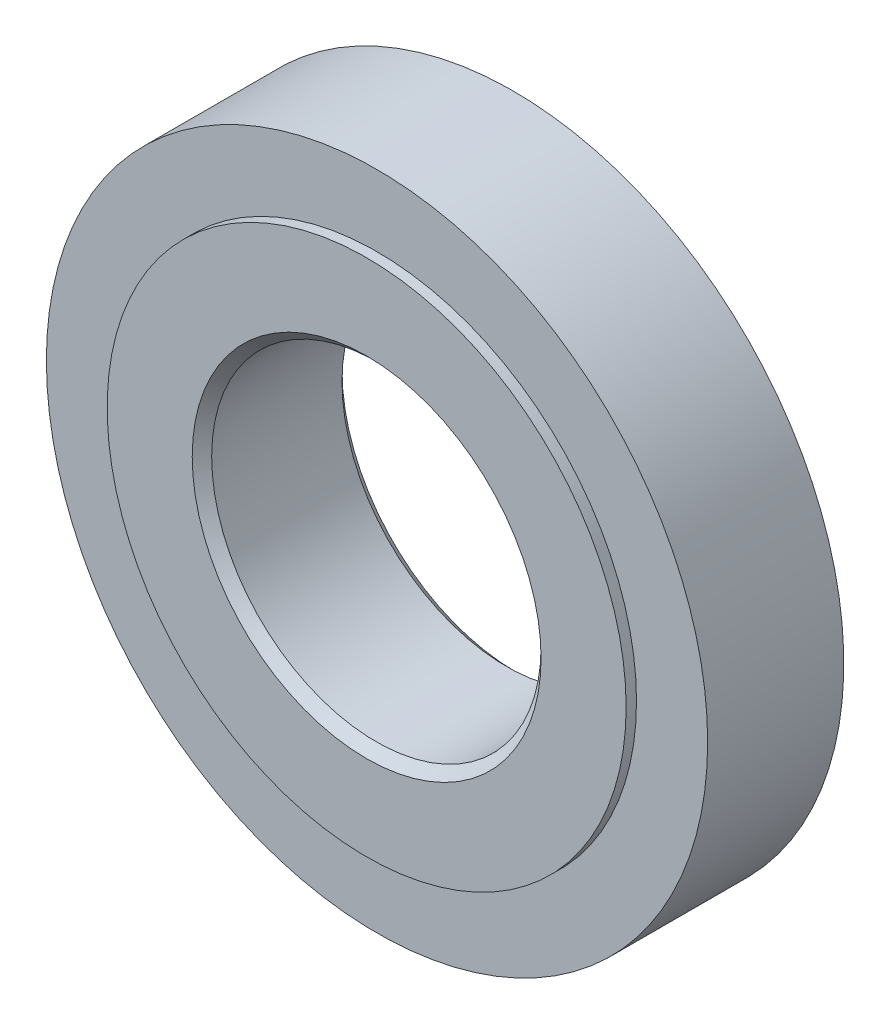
SolidWorks part; units mm, degrees
ref_plane "Front" through (0, 0, 0) normal (0, 0, 1) x (1, 0, 0)
ref_plane "Top" through (0, 0, 0) normal (0, 1, 0) x (1, 0, 0)
ref_plane "Right" through (0, 0, 0) normal (1, 0, 0) x (0, 0, -1)
sketch "Sketch1" plane through (0, 0, 0) normal (0, 0, 1) x (1, 0, 0)
  circle A0 centre (0, 0) radius 51
  dimension "OD" = 102
extrude "Extrude1" add sketch "Sketch1" along normal mid plane 23.1
sketch "Sketch2" plane through (0, 0, 11.55) normal (0, 0, 1) x (1, 0, 0)
  circle A0 centre (0, 0) radius 40.025
  dimension "MG" = 80.05
extrude "Cut-Extrude1" cut sketch "Sketch2" against normal blind 1.6 contours A0 M2
sketch "Sketch3" plane through (0, 0, -11.55) normal (0, 0, -1) x (-1, 0, 0)
  circle A0 centre (0, 0) radius 40.025
  dimension "MG" = 80.05
extrude "Cut-Extrude2" cut sketch "Sketch3" against normal blind 0.5 contours A0 M2
sketch "Sketch4" plane through (0, 0, 11.55) normal (0, 0, 1) x (1, 0, 0)
  circle A0 centre (0, 0) radius 25.405
  dimension "BORE" = 50.81
extrude "Cut-Extrude3" cut sketch "Sketch4" against normal through all
sketch "Sketch5" plane through (0, 0, -11.55) normal (0, 0, 1) x (1, 0, 0)
  point P0 (0, 32)
  point P1 (32, 0)
  point P2 (0, -32)
  point P3 (-32, 0)
  dimension "D1" = 32
  dimension "D2" = 32
  dimension "D3" = 32
  dimension "D4" = 32
hole_wizard "M5x0.8 Tapped Hole1" positions "3DSketch1" profile "Sketch6" tap size "M5x0.8" standard "Ansi Metric"
sketch3d "3DSketch1"
  point P0 (0, 32, -11.55)
  point P3 (-32, 0, -11.55)
  point P6 (32, 0, -11.55)
  point P9 (0, -32, -11.55)
sketch "Sketch6" plane through (0, 32, -11.55) normal (1, 0, 0) x (0, 1, 0)
  line L0 (0, 0) -> (0, 13.9618)
  line L1 (0, 13.9618) -> (2.1, 12.7)
  line L2 (2.1, 12.7) -> (2.1, 0)
  line L5 (2.1, 0) -> (0, 0)
  line L10 (0, 13.9618) -> (-2.1, 12.7) construction
  line L11 (0, -6.35) -> (0, 107.95) construction
  dimension "Tap Drill Dia." = 4.2
  dimension "Tap Drill Depth" = 12.7
  dimension "Drill Angle" = 118
chamfer "Chamfer1" distance 1.5 angle 45 2 edges at (25.405, 0, -11.55) (25.405, 0, 11.55)
sketch "Sketch7" plane through (0, 0, -39) normal (0, 0, -1) x (-1, 0, 0)
  point P0 (53.8815, 53.8815)
  point P1 (53.8815, -53.8815)
  point P3 (0, 76.2)
  point P4 (0, -76.2)
  point P5 (-53.8815, -53.8815)
  point P7 (-53.8815, 53.8815)
  dimension "D1" = 53.8815
  dimension "D2" = 53.8815
  dimension "D3" = 53.8815
  dimension "D4" = 53.8815
  dimension "D5" = 76.2
  dimension "D6" = 76.2
hole_wizard "Ø3.2 (3.2) Diameter Hole1" positions "3DSketch2" profile "Sketch8" hole size "Ø3.2" standard "Ansi Metric"
sketch3d "3DSketch2"
  point P0 (0, 76.2, -31.5)
  point P3 (0, -76.2, -31.5)
sketch "Sketch8" plane through (0, 76.2, -31.5) normal (1, 0, 0) x (0, 1, 0)
  line L0 (0, 0) -> (0, 4.8)
  line L1 (0, 4.8) -> (1.6, 4.8)
  line L2 (1.6, 4.8) -> (1.6, 0)
  line L5 (1.6, 0) -> (0, 0)
  line L10 (0, 4.8) -> (-1.6, 4.8) construction
  line L11 (0, -6.35) -> (0, 107.95) construction
  dimension "Hole Dia." = 3.2
  dimension "Hole Depth" = 4.8
  dimension "Drill Angle" = 180
hole_wizard "M6x1.0 Tapped Hole1" positions "3DSketch3" profile "Sketch9" tap size "M6x1.0" standard "Ansi Metric"
sketch3d "3DSketch3"
  point P0 (53.8815, 53.8815, -39)
  point P3 (-53.8815, 53.8815, -39)
  point P6 (-53.8815, -53.8815, -39)
  point P9 (53.8815, -53.8815, -39)
sketch "Sketch9" plane through (53.8815, 53.8815, -39) normal (1, 0, 0) x (0, 1, 0)
  line L0 (0, 0) -> (0, 14.2022)
  line L1 (0, 14.2022) -> (2.5, 12.7)
  line L2 (2.5, 12.7) -> (2.5, 0)
  line L5 (2.5, 0) -> (0, 0)
  line L10 (0, 14.2022) -> (-2.5, 12.7) construction
  line L11 (0, -6.35) -> (0, 107.95) construction
  dimension "Tap Drill Dia." = 5
  dimension "Tap Drill Depth" = 12.7
  dimension "Drill Angle" = 118
hole_wizard "Ø3.2 (3.2) Diameter Hole2" positions "3DSketch4" profile "Sketch10" hole size "Ø3.2" standard "Ansi Metric"
sketch3d "3DSketch4"
  point P1 (0, 6.8834, -34.4)
  point P4 (0, -6.8834, -34.4)
sketch "Sketch10" plane through (0, 6.8834, -34.4) normal (1, 0, 0) x (0, 1, 0)
  line L0 (0, 0) -> (0, 7.6)
  line L1 (0, 7.6) -> (1.6, 7.6)
  line L2 (1.6, 7.6) -> (1.6, 0)
  line L5 (1.6, 0) -> (0, 0)
  line L10 (0, 7.6) -> (-1.6, 7.6) construction
  line L11 (0, -6.35) -> (0, 107.95) construction
  dimension "Hole Dia." = 3.2
  dimension "Hole Depth" = 7.6
  dimension "Drill Angle" = 180
hole_wizard "M3x0.5 Tapped Hole1" positions "3DSketch5" profile "Sketch11" tap size "M3x0.5" standard "Ansi Metric"
sketch3d "3DSketch5"
  point P1 (6.8834, 0, -34.4)
  point P4 (-6.8834, 0, -34.4)
sketch "Sketch11" plane through (6.8834, 0, -34.4) normal (1, 0, 0) x (0, 1, 0)
  line L0 (0, 0) -> (0, 5.5511)
  line L1 (0, 5.5511) -> (1.25, 4.8)
  line L2 (1.25, 4.8) -> (1.25, 0)
  line L5 (1.25, 0) -> (0, 0)
  line L10 (0, 5.5511) -> (-1.25, 4.8) construction
  line L11 (0, -6.35) -> (0, 107.95) construction
  dimension "Tap Drill Dia." = 2.5
  dimension "Tap Drill Depth" = 4.8
  dimension "Drill Angle" = 118
hole_wizard "M4x0.7 Tapped Hole1" positions "3DSketch6" profile "Sketch12" tap size "M4x0.7" standard "Ansi Metric"
sketch3d "3DSketch6"
  point P0 (0, 18, -67.5)
  point P3 (18, 0, -67.5)
  point P6 (0, -18, -67.5)
  point P9 (-18, 0, -67.5)
sketch "Sketch12" plane through (0, 18, -67.5) normal (1, 0, 0) x (0, 1, 0)
  line L0 (0, 0) -> (0, 8.9914)
  line L1 (0, 8.9914) -> (1.65, 8)
  line L2 (1.65, 8) -> (1.65, 0)
  line L5 (1.65, 0) -> (0, 0)
  line L10 (0, 8.9914) -> (-1.65, 8) construction
  line L11 (0, -6.35) -> (0, 107.95) construction
  dimension "Tap Drill Dia." = 3.3
  dimension "Tap Drill Depth" = 8
  dimension "Drill Angle" = 118
hole_wizard "M6x1.0 Tapped Hole2" positions "3DSketch7" profile "Sketch13" tap size "M6x1.0" standard "Ansi Metric"
sketch3d "3DSketch7"
  point P0 (-32, 0, -11.55)
  point P3 (0, 32, -11.55)
  point P6 (0, -32, -11.55)
  point P9 (32, 0, -11.55)
sketch "Sketch13" plane through (-32, 0, -11.55) normal (1, 0, 0) x (0, 1, 0)
  line L0 (0, 0) -> (0, 14.2022)
  line L1 (0, 14.2022) -> (2.5, 12.7)
  line L2 (2.5, 12.7) -> (2.5, 0)
  line L5 (2.5, 0) -> (0, 0)
  line L10 (0, 14.2022) -> (-2.5, 12.7) construction
  line L11 (0, -6.35) -> (0, 107.95) construction
  dimension "Tap Drill Dia." = 5
  dimension "Tap Drill Depth" = 12.7
  dimension "Drill Angle" = 118
